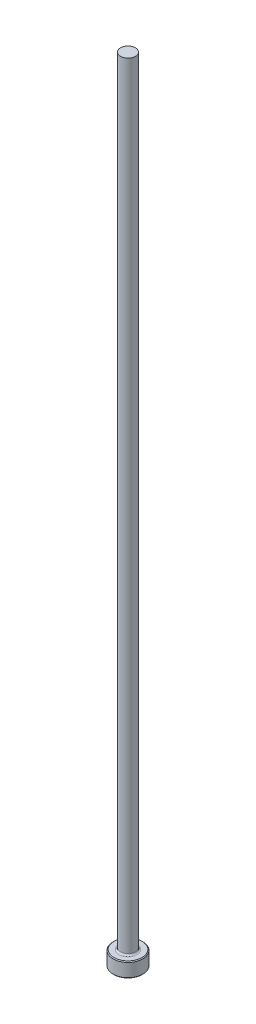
SolidWorks part; units mm, degrees
ref_plane "Front Plane" through (0, 0, 0) normal (0, 0, 1) x (1, 0, 0)
ref_plane "Top Plane" through (0, 0, 0) normal (0, 1, 0) x (1, 0, 0)
ref_plane "Right Plane" through (0, 0, 0) normal (1, 0, 0) x (0, 0, -1)
sketch "Sketch1" plane through (0, 0, 0) normal (0, 0, 1) x (1, 0, 0)
  line L0 (0, 259.9588) -> (0, -15.1925) construction
  line L1 (0, 0) -> (-4.7625, 0)
  line L2 (-4.7625, 0) -> (-4.7625, 4.7498)
  line L3 (-4.7625, 4.7498) -> (-2.3812, 4.7498)
  line L4 (-2.3812, 4.7498) -> (-2.3812, 254)
  line L5 (-2.3812, 254) -> (0, 254)
  line L6 (0, 254) -> (0, 0)
  dimension "L" = 254
  dimension "H" = 9.525
  dimension "T" = 4.7498
  dimension "D" = 4.7625
revolve "Revolve1" add sketch "Sketch1" angle 360 about L0
chamfer "Chamfer1" distance 0.254 angle 45 2 edges at (0, 4.7498, 4.7625) (0, 0, 4.7625)
fillet "Fillet1" radius 0.508 1 edges at (0, 4.7498, 2.3812)
sketch "Pocket Sketch" plane through (0, 0, 0) normal (0, 0, 1) x (1, 0, 0)
  line L0 (-5.1594, 0) -> (-5.1594, 4.7752)
  line L1 (-5.1594, 4.7752) -> (-3.3417, 4.7752)
  line L2 (-2.5797, 5.5372) -> (-2.5797, 22.225)
  line L3 (-2.5797, 22.225) -> (0, 22.225)
  line L4 (0, 22.225) -> (0, 0)
  line L5 (0, 0) -> (-5.1594, 0)
  line L6 (0, 12.6104) -> (0, -2.4989) construction
  line L7 (-4.7625, 4.4958) -> (-4.7625, 0.254) construction
  line L8 (4.5085, 4.7498) -> (-4.5085, 4.7498) construction
  line L9 (-2.3812, 254) -> (-2.3812, 5.2578) construction
  line L10 (-3.3417, 4.7752) -> (-2.5797, 5.5372)
  point P3 (-2.5797, 4.7752)
  dimension "D1" = 10.3187
  dimension "D2" = 0.3969
  dimension "D3" = 0.0254
  dimension "D4" = 0.1984
  dimension "D5" = 5.1594
  dimension "D6" = 22.225
